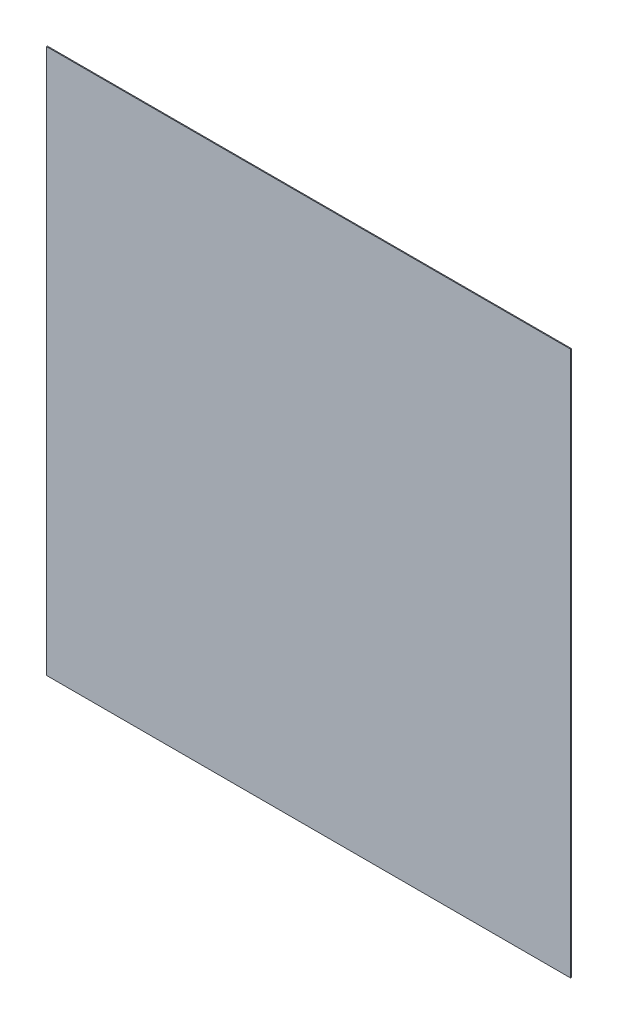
SolidWorks part; units mm, degrees
ref_plane "Plan de face" through (0, 0, 0) normal (0, 0, 1) x (1, 0, 0)
ref_plane "Plan de dessus" through (0, 0, 0) normal (0, 1, 0) x (1, 0, 0)
ref_plane "Plan de droite" through (0, 0, 0) normal (1, 0, 0) x (0, 0, -1)
sketch "Esquisse1" plane through (0, 0, 0) normal (0, 0, 1) x (1, 0, 0)
  line L1 (0, 0) -> (2300, 0)
  line L2 (0, 0) -> (0, 2390)
  line L3 (0, 2390) -> (2300, 2390)
  line L4 (2300, 0) -> (2300, 2390)
  dimension "D1" = 2300
  dimension "D2" = 2390
extrude "Boss.-Extru.1" add sketch "Esquisse1" along normal blind 4
